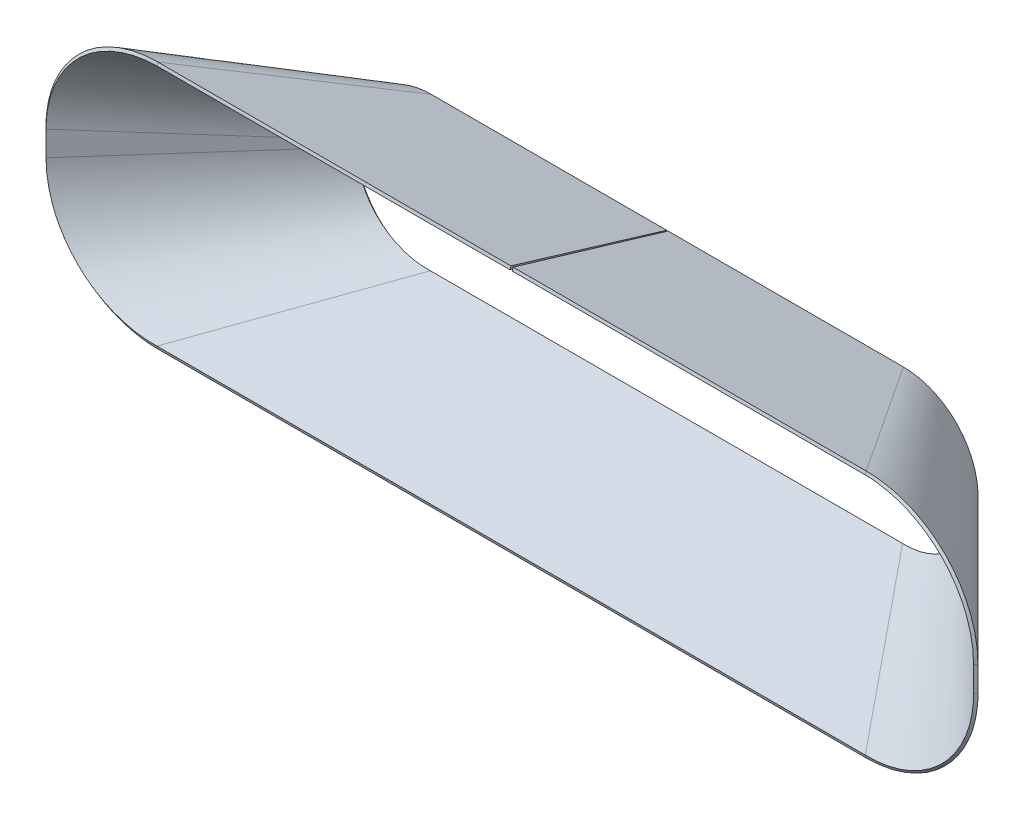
SolidWorks part; units mm, degrees
ref_plane "Ebene vorne" through (0, 0, 0) normal (0, 0, 1) x (1, 0, 0)
ref_plane "Ebene oben" through (0, 0, 0) normal (0, 1, 0) x (1, 0, 0)
ref_plane "Ebene rechts" through (0, 0, 0) normal (1, 0, 0) x (0, 0, -1)
sketch3d "3D-Skizze1"
  line L0 (285, 100, 375) -> (0.8727, 100, 375) construction
  line L1 (375, 10, 375) -> (375, -10, 375) construction
  line L2 (285, -100, 375) -> (-285, -100, 375) construction
  line L3 (-0.8727, 100, 375) -> (-285, 100, 375) construction
  line L4 (-375, 10, 375) -> (-375, -10, 375) construction
  line L5 (285, 100, 375) -> (0.8727, 100, 375)
  line L6 (375, 10, 375) -> (375, -10, 375)
  line L7 (285, -100, 375) -> (-285, -100, 375)
  line L8 (-0.8727, 100, 375) -> (-285, 100, 375)
  line L9 (-375, 10, 375) -> (-375, -10, 375)
  arc A0 (285, 100, 375) -> (375, 10, 375) centre (285, 10, 375) ccw construction
  arc A1 (375, -10, 375) -> (285, -100, 375) centre (285, -10, 375) ccw construction
  arc A2 (-285, -100, 375) -> (-375, -10, 375) centre (-285, -10, 375) ccw construction
  arc A3 (-285, 100, 375) -> (-375, 10, 375) centre (-285, 10, 375) ccw construction
  arc A4 (285, 100, 375) -> (375, 10, 375) centre (285, 10, 375) ccw
  arc A5 (375, -10, 375) -> (285, -100, 375) centre (285, -10, 375) ccw
  arc A6 (-285, -100, 375) -> (-375, -10, 375) centre (-285, -10, 375) ccw
  arc A7 (-285, 100, 375) -> (-375, 10, 375) centre (-285, 10, 375) ccw
  point P5 (285, 10, 285)
  point P9 (285, -10, 285)
  point P15 (-285, -10, 285)
  point P17 (285, 10, 285)
  point P18 (285, -10, 285)
  point P19 (-285, 10, 465)
  point P20 (-285, -10, 285)
  point P21 (-285, 10, 465)
sketch3d "3D-Skizze2"
  line L0 (190, 62.5, 250) -> (0.5454, 62.5, 250) construction
  line L1 (250, -2.5, 250) -> (250, 2.5, 250) construction
  line L2 (190, -62.5, 250) -> (-190, -62.5, 250) construction
  line L3 (-0.5454, 62.5, 250) -> (-190, 62.5, 250) construction
  line L4 (-250, -2.5, 250) -> (-250, 2.5, 250) construction
  line L5 (190, 62.5, 250) -> (0.5454, 62.5, 250)
  line L6 (250, -2.5, 250) -> (250, 2.5, 250)
  line L7 (190, -62.5, 250) -> (-190, -62.5, 250)
  line L8 (-0.5454, 62.5, 250) -> (-190, 62.5, 250)
  line L9 (-250, -2.5, 250) -> (-250, 2.5, 250)
  arc A0 (250, 2.5, 250) -> (190, 62.5, 250) centre (190, 2.5, 250) ccw construction
  arc A1 (190, -62.5, 250) -> (250, -2.5, 250) centre (190, -2.5, 250) ccw construction
  arc A2 (-190, -62.5, 250) -> (-250, -2.5, 250) centre (-190, -2.5, 250) ccw construction
  arc A3 (-190, 62.5, 250) -> (-250, 2.5, 250) centre (-190, 2.5, 250) ccw construction
  arc A4 (250, 2.5, 250) -> (190, 62.5, 250) centre (190, 2.5, 250) ccw
  arc A5 (190, -62.5, 250) -> (250, -2.5, 250) centre (190, -2.5, 250) ccw
  arc A6 (-190, -62.5, 250) -> (-250, -2.5, 250) centre (-190, -2.5, 250) ccw
  arc A7 (-190, 62.5, 250) -> (-250, 2.5, 250) centre (-190, 2.5, 250) ccw
  point P5 (190, 2.5, 310)
  point P9 (190, -2.5, 310)
  point P15 (-190, -2.5, 190)
  point P17 (190, 2.5, 310)
  point P18 (190, -2.5, 310)
  point P19 (-190, 2.5, 310)
  point P20 (-190, -2.5, 190)
  point P21 (-190, 2.5, 310)
sheet metal parameters "Blech1" thickness 2.5 parameters "D1"=0, "Dicke"=2.5
lofted bend "Ausgeformte Biegungen1" parameters "D1"=0, "D12"=2.5
other "Freiform-Biegung1" parameters "D1"=1000, "D4"=57.296, "D5"=1
other "Freiform-Biegung2" parameters "D1"=1000, "D4"=57.296, "D5"=2
other "Freiform-Biegung3" parameters "D1"=1000, "D4"=57.296, "D5"=3
other "Freiform-Biegung4" parameters "D1"=1000, "D4"=57.296, "D5"=4
flat pattern "Abwicklung1"
sketch "Biegung-Linien1" plane through (0, 0, 0) normal (0, 1, 0) x (-1, 0, 0)
other "Abwickeln-<Freiform-Biegung1>1"
other "Abwickeln-<Freiform-Biegung2>1"
other "Abwickeln-<Freiform-Biegung3>1"
other "Abwickeln-<Freiform-Biegung4>1"
